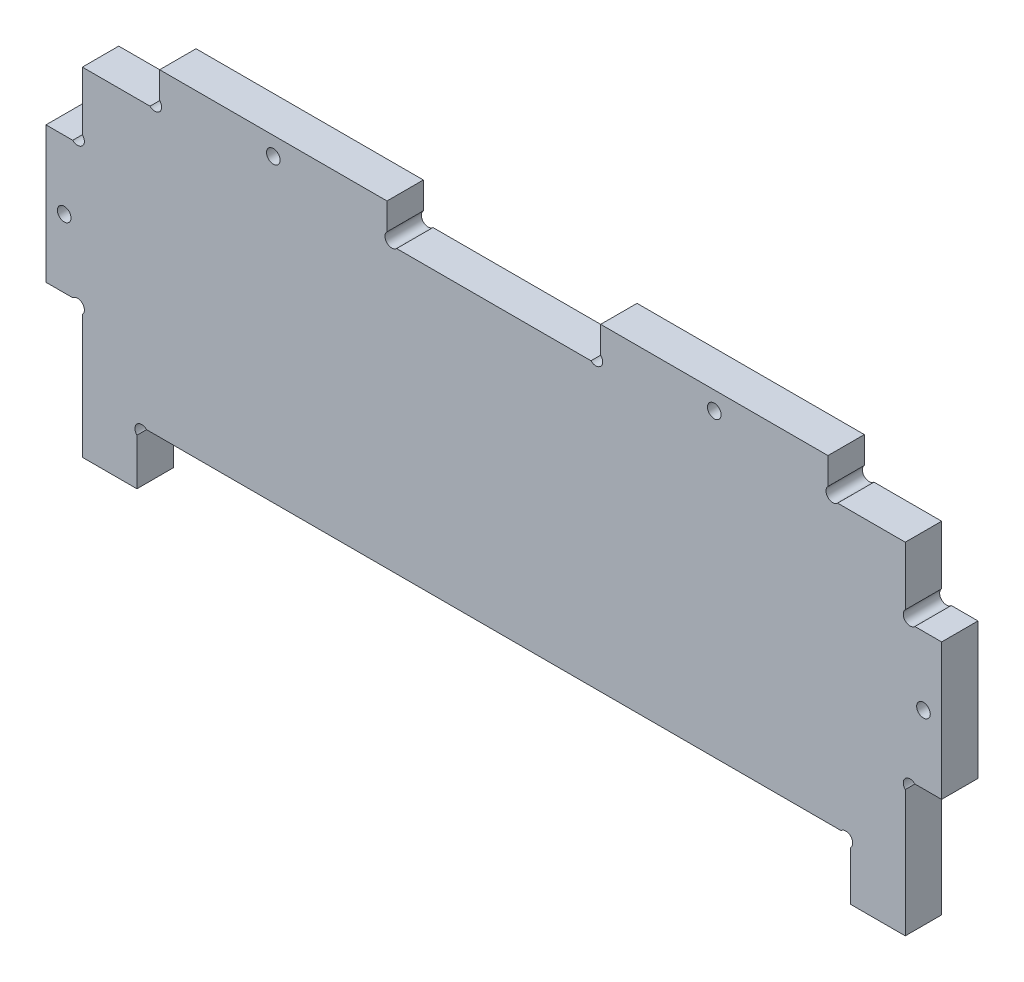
SolidWorks part; units mm, degrees
ref_plane "Plan de face" through (0, 0, 0) normal (0, 0, 1) x (1, 0, 0)
ref_plane "Plan de dessus" through (0, 0, 0) normal (0, 1, 0) x (1, 0, 0)
ref_plane "Plan de droite" through (0, 0, 0) normal (1, 0, 0) x (0, 0, -1)
sketch "Esquisse1" plane through (0, 0, 0) normal (0, 0, 1) x (1, 0, 0)
  line L0 (125.8356, 33.4633) -> (75.8356, 25.4633) construction
  line L1 (-38.1644, 25.4633) -> (-23.2857, 25.4633)
  line L2 (-38.1644, -22.0974) -> (-38.1644, -21.658)
  line L3 (150.8356, 10.4633) -> (142.8356, -19.5367) construction
  line L4 (-24.0431, -36.5367) -> (128.7143, -36.5367)
  line L5 (-38.1644, -36.5367) -> (-38.1644, -48.8693)
  line L6 (-38.1644, -48.8693) -> (-26.1644, -48.8693)
  line L7 (-26.1644, -36.5367) -> (-13.6905, -49.0107) construction
  line L9 (75.8356, 33.4633) -> (75.8356, 27.5846)
  line L10 (125.8356, 33.4633) -> (75.8356, 33.4633)
  line L13 (-46.1644, -19.5367) -> (-46.1644, 10.4633)
  line L14 (-46.1644, 10.4633) -> (-40.2857, 10.4633)
  line L15 (-38.1644, -22.0974) -> (-38.1644, -36.5367)
  line L16 (-40.2857, -19.5367) -> (-46.1644, -19.5367)
  line L17 (-38.1644, 13.0239) -> (-38.1644, 25.4633)
  line L18 (125.8356, 27.5846) -> (125.8356, 33.4633)
  line L20 (142.8356, 12.5846) -> (142.8356, 13.0239)
  line L21 (142.8356, 13.0239) -> (142.8356, 25.4633)
  line L22 (-38.1644, 12.5846) -> (-38.1644, 13.0239)
  line L23 (-46.1644, 10.4633) -> (-38.1644, -19.5367) construction
  line L24 (-21.1644, 33.4633) -> (28.8356, 25.4633) construction
  line L25 (130.8356, -36.5367) -> (116.9693, -50.403) construction
  line L26 (144.9569, -19.5367) -> (150.8356, -19.5367)
  line L27 (142.8356, -22.0974) -> (142.8356, -36.5367)
  line L28 (-21.1644, 27.5846) -> (-21.1644, 33.4633)
  line L29 (-46.1644, 33.4633) -> (153.8356, 33.4633) construction
  line L30 (-21.1644, 33.4633) -> (28.8356, 33.4633)
  line L31 (28.8356, 33.4633) -> (28.8356, 27.5846)
  line L32 (30.9569, 25.4633) -> (73.7143, 25.4633)
  line L33 (150.8356, 10.4633) -> (144.9569, 10.4633)
  line L34 (150.8356, -19.5367) -> (150.8356, 10.4633)
  line L36 (142.8356, -22.0974) -> (142.8356, -21.658)
  line L37 (142.8356, 25.4633) -> (127.9569, 25.4633)
  line L38 (-26.1644, -48.8693) -> (-26.1644, -38.658)
  line L39 (142.8356, -36.5367) -> (142.8356, -49.5367)
  line L40 (142.8356, -49.5367) -> (130.8356, -49.5367)
  line L42 (130.8356, -49.5367) -> (130.8356, -38.658)
  arc A0 (-24.0431, -36.5367) -> (-26.1644, -38.658) centre (-25.1037, -37.5974) ccw
  circle A1 centre (100.8356, 29.4633) radius 1.5
  arc A2 (130.8356, -38.658) -> (128.7143, -36.5367) centre (129.7749, -37.5974) ccw
  circle A3 centre (146.8356, -4.5367) radius 1.5
  arc A4 (75.8356, 27.5846) -> (73.7143, 25.4633) centre (74.7749, 26.5239) cw
  arc A5 (-38.1644, -21.658) -> (-40.2857, -19.5367) centre (-39.2251, -20.5974) ccw
  arc A6 (-40.2857, 10.4633) -> (-38.1644, 12.5846) centre (-39.2251, 11.5239) ccw
  arc A7 (127.9569, 25.4633) -> (125.8356, 27.5846) centre (126.8963, 26.5239) cw
  arc A8 (144.9569, 10.4633) -> (142.8356, 12.5846) centre (143.8963, 11.5239) cw
  arc A9 (-23.2857, 25.4633) -> (-21.1644, 27.5846) centre (-22.2251, 26.5239) ccw
  arc A10 (28.8356, 27.5846) -> (30.9569, 25.4633) centre (29.8963, 26.5239) ccw
  arc A11 (142.8356, -21.658) -> (144.9569, -19.5367) centre (143.8963, -20.5974) cw
  circle A13 centre (-42.1644, -4.5367) radius 1.5
  circle A14 centre (3.8356, 29.4633) radius 1.5
  dimension "D3" = 45
  dimension "D2" = 12
  dimension "D1" = 50
  dimension "D6" = 12
  dimension "D4" = 45
extrude "Boss.-Extru.1" add sketch "Esquisse1" along normal blind 8
